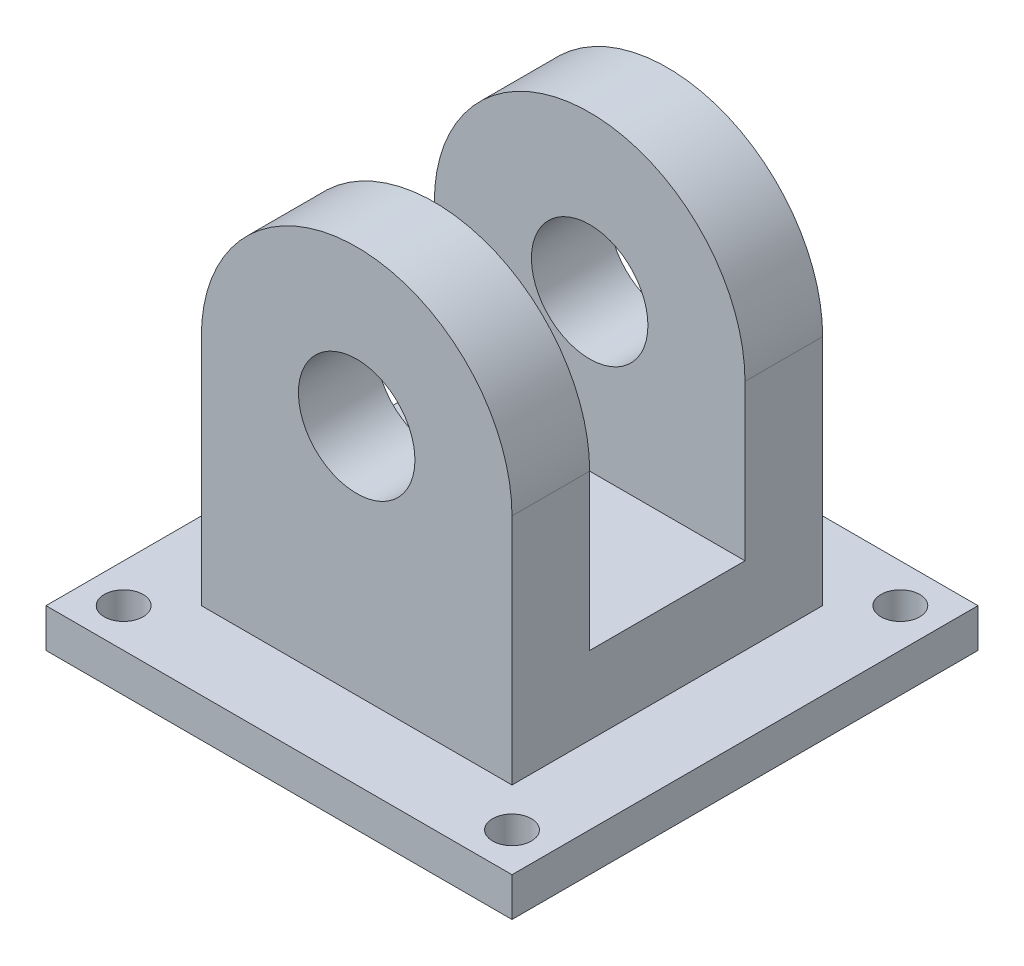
SolidWorks part; units mm, degrees
ref_plane "Plan de face" through (0, 0, 0) normal (0, 0, 1) x (1, 0, 0)
ref_plane "Plan de dessus" through (0, 0, 0) normal (0, 1, 0) x (1, 0, 0)
ref_plane "Plan de droite" through (0, 0, 0) normal (1, 0, 0) x (0, 0, -1)
sketch "Esquisse1" plane through (0, 0, 0) normal (0, 0, 1) x (1, 0, 0)
  line L0 (0, 0) -> (-40, 0)
  line L1 (-40, 0) -> (-40, 30)
  line L2 (0, 30) -> (0, 0)
  arc A0 (-40, 30) -> (0, 30) centre (-20, 30) cw
  dimension "D1" = 30
  dimension "D2" = 40
extrude "Boss.-Extru.1" add sketch "Esquisse1" along normal blind 40 contours L1 A0 L2 L0
sketch "Esquisse2" plane through (0, 0, 0) normal (1, 0, 0) x (0, 0, -1)
  line L0 (-40, 50) -> (-40, 30) construction
  line L1 (-30, 57.0205) -> (-10, 57.0205)
  line L2 (-30, 57.0205) -> (-30, 10)
  line L3 (-30, 10) -> (-10, 10)
  line L4 (-10, 57.0205) -> (-10, 10)
  line L5 (0, 30) -> (0, 0) construction
  line L6 (-40, 0) -> (0, 0) construction
  dimension "D1" = 10
  dimension "D2" = 10
  dimension "D3" = 10
extrude "Enlèv. mat.-Extru.1" cut sketch "Esquisse2" against normal through all contours L1 L4 L3 L2
sketch "Esquisse4" plane through (0, 0, 30) normal (0, 0, -1) x (-1, 0, 0)
  circle A0 centre (20, 30) radius 7.5
  dimension "D1" = 15
extrude "Enlèv. mat.-Extru.2" cut sketch "Esquisse4" against normal through all both and the other way through all contours A0
sketch "Esquisse5" plane through (0, 0, 0) normal (0, -1, 0) x (1, 0, 0)
  line L0 (0, 40) -> (-40, 40) construction
  line L1 (10, -10) -> (-50, -10)
  line L2 (10, -10) -> (10, 50)
  line L3 (10, 50) -> (-50, 50)
  line L4 (-50, -10) -> (-50, 50)
  line L5 (0, 40) -> (0, 0) construction
  line L6 (0, 0) -> (-40, 0) construction
  line L7 (-40, 10) -> (-40, 0) construction
  point P10 (-40, 5)
  dimension "D1" = 10
  dimension "D2" = 10
  dimension "D3" = 10
  dimension "D4" = 10
extrude "Boss.-Extru.6" add sketch "Esquisse5" along normal blind 5 contours L3 L4 L1 L2
sketch "Esquisse6" plane through (0, 0, 0) normal (0, 1, 0) x (1, 0, 0)
  line L0 (-50, 10) -> (-50, -50) construction
  line L1 (10, 10) -> (-50, 10) construction
  line L2 (10, 10) -> (10, -50) construction
  line L3 (10, -50) -> (-50, -50) construction
  circle A0 centre (-45, 5) radius 2.5
  circle A1 centre (5, 5) radius 2.5
  circle A2 centre (5, -45) radius 2.5
  circle A3 centre (-45, -45) radius 2.5
  dimension "D1" = 5
  dimension "D2" = 5
  dimension "D3" = 5
  dimension "D4" = 5
  dimension "D5" = 5
  dimension "D6" = 5
  dimension "D7" = 5
  dimension "D8" = 5
  dimension "D9" = 5
extrude "Enlèv. mat.-Extru.3" cut sketch "Esquisse6" against normal through all
